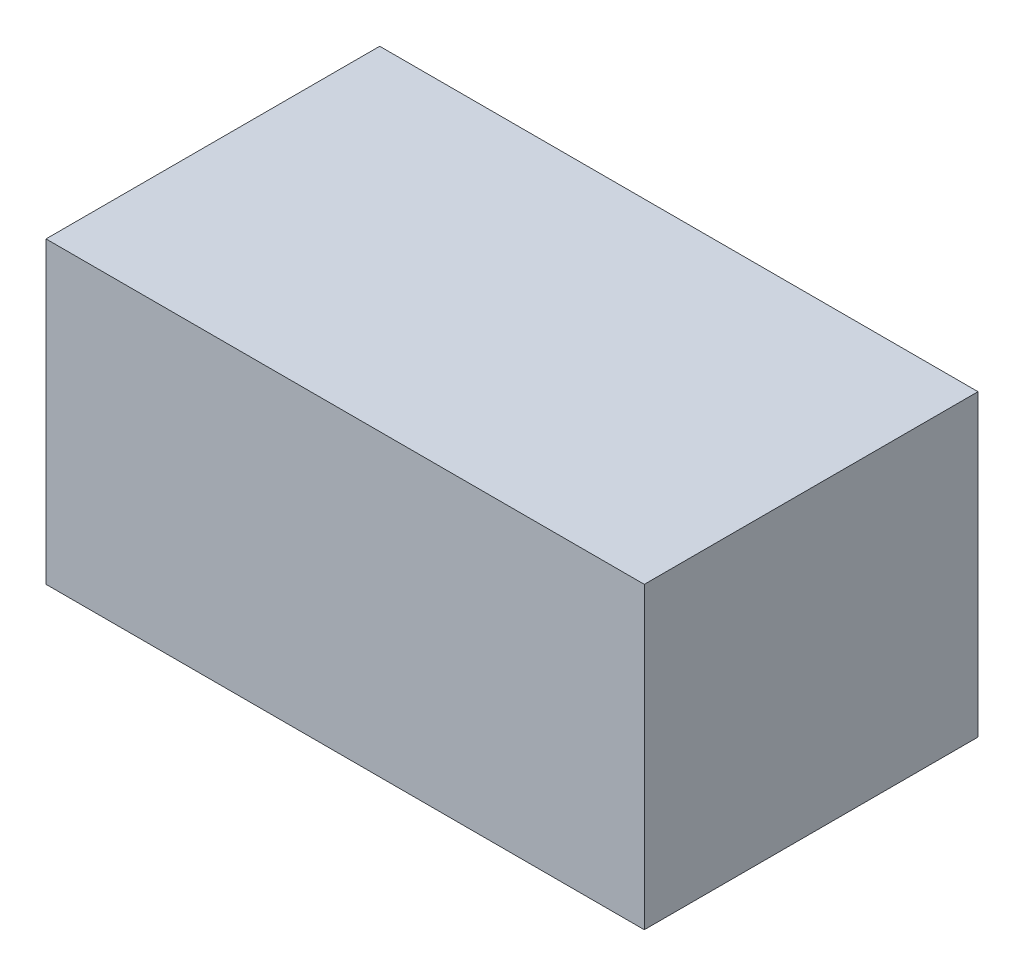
SolidWorks part; units mm, degrees
ref_plane "Front Plane" through (0, 0, 0) normal (0, 0, 1) x (1, 0, 0)
ref_plane "Top Plane" through (0, 0, 0) normal (0, 1, 0) x (1, 0, 0)
ref_plane "Right Plane" through (0, 0, 0) normal (1, 0, 0) x (0, 0, -1)
sketch "GENERAL" plane through (0, 0, 0) normal (0, 0, 1) x (1, 0, 0)
  line L4 (-0.762, -0.381) -> (0.762, -0.381)
  line L5 (0.762, -0.381) -> (0.762, 0.381)
  line L6 (0.762, 0.381) -> (-0.762, 0.381)
  line L7 (-0.762, 0.381) -> (-0.762, -0.381)
extrude "Boss-Extrude1" add sketch "GENERAL" along normal blind 0.85
